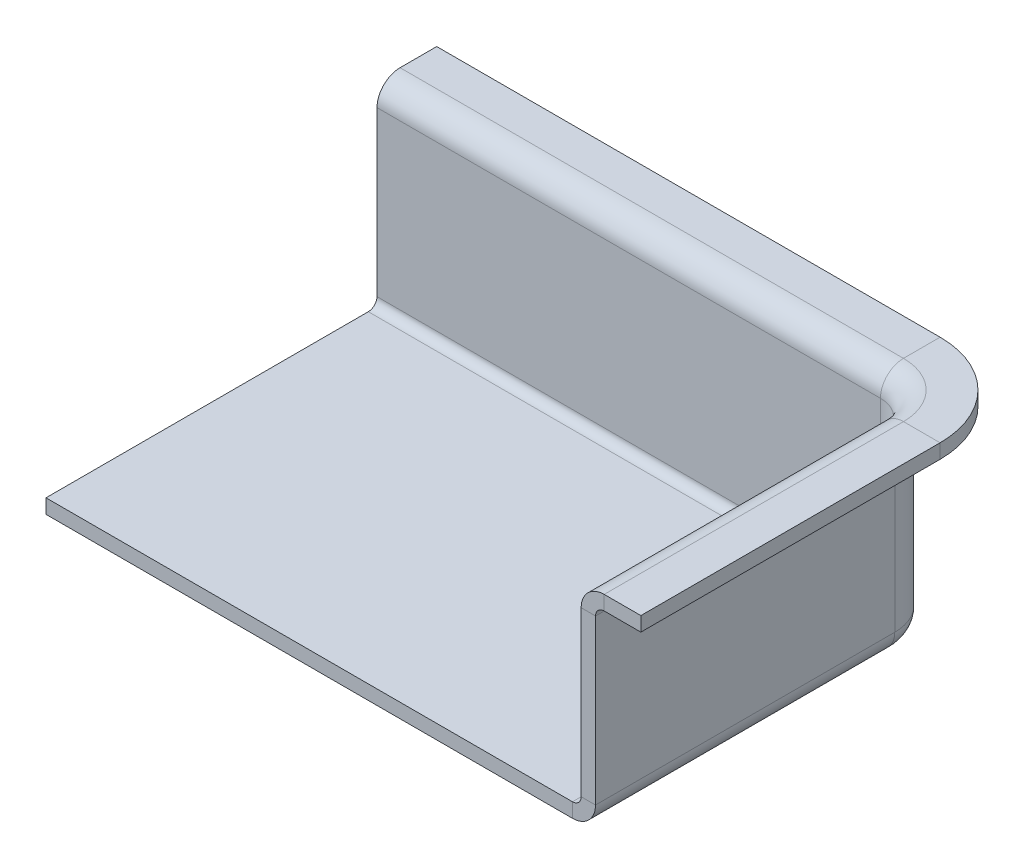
SolidWorks part; units mm, degrees
ref_plane "Front Plane" through (0, 0, 0) normal (0, 0, 1) x (1, 0, 0)
ref_plane "Top Plane" through (0, 0, 0) normal (0, 1, 0) x (1, 0, 0)
ref_plane "Right Plane" through (0, 0, 0) normal (1, 0, 0) x (0, 0, -1)
sketch "Sketch1" plane through (0, 0, 0) normal (0, 1, 0) x (1, 0, 0)
  line L1 (-64.6141, 37.9564) -> (61.7895, 37.9564)
  line L2 (-64.6141, 37.9564) -> (-64.6141, -41.4872)
  line L3 (-64.6141, -41.4872) -> (61.7895, -41.4872)
  line L4 (61.7895, 37.9564) -> (61.7895, -41.4872)
sheet metal parameters "Sheet-Metal1" thickness 3.302 parameters "D1"=2
base flange "Base-Flange1" sketch "Sketch1" thickness 3.302 reverse thickness direction no parameters "D1"=2
sketch "Sketch4" plane through (0, 0, 41.4872) normal (0, 0, 1) x (1, 0, 0)
  line L0 (61.7895, 0) -> (61.7895, 41.657)
  line L1 (61.7895, 41.657) -> (72.221, 41.657)
swept flange "Swept Flange1" parameters "D1"=2
sketch "Sketch10" plane through (61.7895, 0, 41.4872) normal (0, 1, 0) x (0, 0, 1)
  line L0 (0, 0) -> (-79.4436, 0) construction
  line L1 (0, 0) -> (-79.4436, 0)
  line L2 (-79.4436, 0) -> (-79.4436, -126.4036) construction
  line L3 (-79.4436, 0) -> (-79.4436, -126.4036)
other "Sweptbend1_1" parameters "D1"=0, "D4"=90, "D5"=1
other "Sweptbend1_2" parameters "D1"=0, "D4"=270, "D5"=2
other "Sweptbend2_1" parameters "D1"=0, "D4"=90, "D5"=3
flat pattern "Flat-Pattern1"
sketch "Bend-Lines1" plane through (0, 0, 0) normal (0, 1, 0) x (1, 0, 0)
sketch3d "Bounding-Box1" [suppressed]
  line L0 (-61.7895, -41.4872, 0) -> (64.6141, -41.4872, 0) construction
  line L1 (-61.7895, 37.9564, 0) -> (64.6141, 37.9564, 0) construction
  line L2 (-61.7895, -41.4872, 0) -> (-61.7895, 37.9564, 0) construction
  line L3 (64.6141, -41.4872, 0) -> (64.6141, 37.9564, 0) construction
bend of the flat pattern "Flatten-<Sweptbend1_1>1"
bend of the flat pattern "Flatten-<Sweptbend1_2>1"
bend of the flat pattern "Flatten-<Sweptbend2_1>1"
